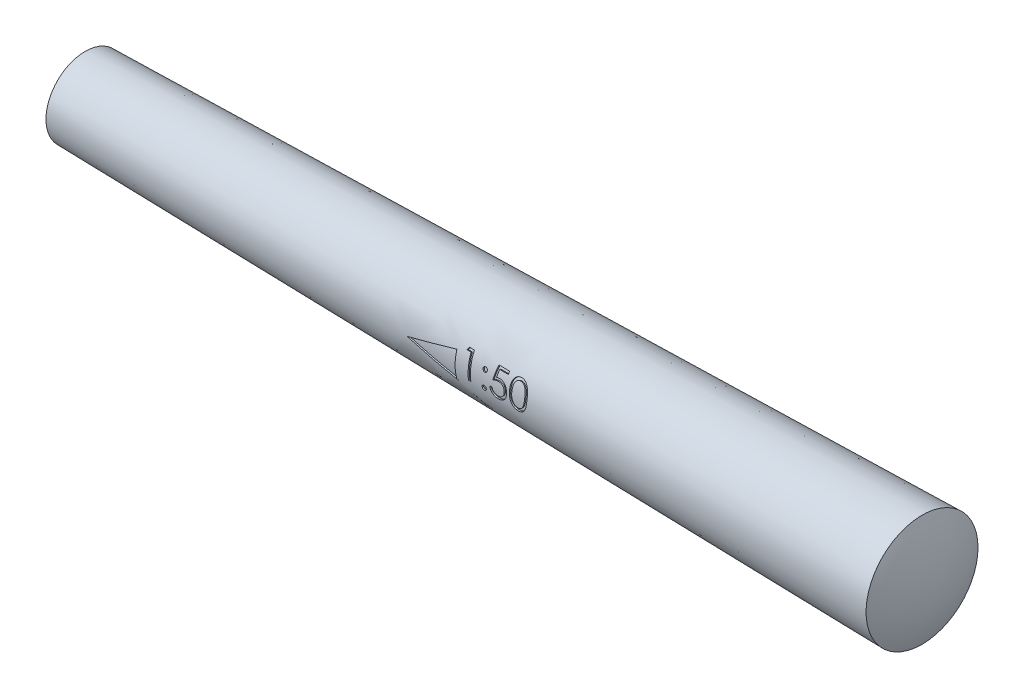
SolidWorks part; units mm, degrees
ref_plane "Front Plane" through (0, 0, 0) normal (0, 0, 1) x (1, 0, 0)
ref_plane "Top Plane" through (0, 0, 0) normal (0, 1, 0) x (1, 0, 0)
ref_plane "Right Plane" through (0, 0, 0) normal (1, 0, 0) x (0, 0, -1)
sketch "Sketch1" plane through (0, 0, 0) normal (1, 0, 0) x (0, 0, -1)
  circle A0 centre (0, 0) radius 1.5
  dimension "D1" = 3
extrude "Extrude1" add sketch "Sketch1" along normal mid plane 32
draft "Draft1" type of draft neutral plane draft angle 1.146 faces to draft 1 parameters "D1"=1.146
sketch "Sketch2" plane through (0, 0, 0) normal (0, 0, 1) x (1, 0, 0)
  line L0 (-16, 0) -> (-16, 1.5)
  line L1 (-16, 1.5) -> (-16, -1.5) construction
  line L2 (-16, 0) -> (-16.45, 0)
  line L3 (-16.45, 0) -> (-16.45, -1.82) construction
  line L4 (16, 0) -> (16, 2.14)
  line L5 (16, -2.14) -> (16, 2.14) construction
  line L6 (16, 0) -> (16.45, 0)
  line L7 (16.45, 0) -> (16.45, -1.82) construction
  line L8 (-16, -1.5) -> (16, -2.14) construction
  arc A0 (-16.45, 0) -> (-16, 1.5) centre (-13.725, 0) cw
  arc A1 (16.45, 0) -> (16, 2.14) centre (11.1365, 0) ccw
  point P14 (0, -1.82)
revolve "Revolve1" add sketch "Sketch2" angle 360 about L2
sketch "Sketch5" plane through (0, 0, 0) normal (0, 0, 1) x (1, 0, 0)
  line L0 (0, 1.82) -> (0, -1.82) construction
  line L1 (16, 2.14) -> (-16, 1.5) construction
  line L2 (-16, -1.5) -> (16, -2.14) construction
ref_plane "Plane2" through (0, 0, 0) normal (-0.02, 0, 0.9998) x (0.9998, 0, 0.02)
sketch "Sketch6" plane through (0, 0, 0) normal (-0.02, 0, 0.9998) x (0.9998, 0, 0.02)
  line L0 (0, 0) -> (0, 0.5)
  line L1 (0, 1.82) -> (0, -1.82) construction
  line L2 (0, 0.5) -> (-1.866, 0)
  line L3 (-1.866, 0) -> (0, -0.5)
  line L4 (0, -0.5) -> (0, 0)
  line L5 (0, -0.25) -> (3, -0.25) construction
  text T0 "1:50" font "Century Gothic" height 1
  dimension "D1" = 1
  dimension "D2" = 30
  dimension "D3" = 3
wrap "Wrap2" sketch "Sketch6" wrap type deboss source sketch "Sketch6" thickness 0.05 parameters "D1"=0.05
equation "\"D2@Sketch2\" = \"D1@Sketch2\""
